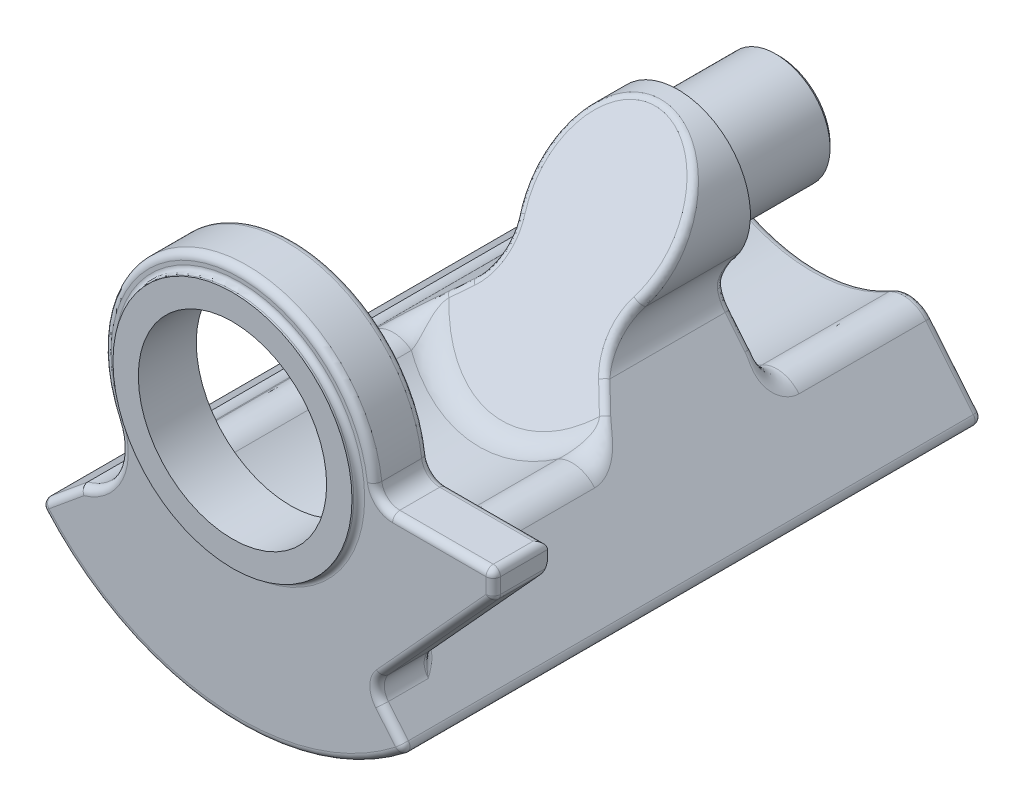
SolidWorks part; units mm, degrees
ref_plane "Plan de face" through (0, 0, 0) normal (0, 0, 1) x (1, 0, 0)
ref_plane "Plan de dessus" through (0, 0, 0) normal (0, 1, 0) x (1, 0, 0)
ref_plane "Plan de droite" through (0, 0, 0) normal (1, 0, 0) x (0, 0, -1)
sketch "Esquisse1" plane through (0, 0, 0) normal (0, 0, 1) x (1, 0, 0)
  line L0 (0, 57.9021) -> (0, -96.26) construction
  line L1 (0, 0) -> (108.6423, 0) construction
  line L2 (0, 0) -> (-55.5055, -45.86) construction
  line L3 (0, 0) -> (-61.5936, 0) construction
  line L4 (42.2049, 0) -> (70, 0)
  line L5 (70, 0) -> (70, -7)
  line L6 (45.86, -55.5055) -> (39.0709, -47.2886)
  line L7 (39.2313, -40.7344) -> (70, -7)
  line L8 (-55.5055, -45.86) -> (-43.9419, -36.3058)
  line L11 (45.86, -55.5055) -> (0, 0) construction
  arc A1 (37.2396, 4.4118) -> (-34.1143, -15.5713) centre (0, 0) ccw
  arc A2 (-55.5055, -45.86) -> (45.86, -55.5055) centre (0, 0) ccw
  arc A3 (39.0709, -47.2886) -> (39.2313, -40.7344) centre (42.9255, -44.1038) cw
  arc A4 (37.2396, 4.4118) -> (42.2049, 0) centre (42.2049, 5) ccw
  arc A5 (-34.1143, -15.5713) -> (-43.9419, -36.3058) centre (-47.76, -21.7999) cw
  point P18 (36.3058, -43.9419)
  point P21 (37.5, 0)
  dimension "D2" = 37.5
  dimension "D9" = 5
  dimension "D10" = 15
  dimension "D11" = 72
  dimension "D3" = 15
  dimension "D4" = 70
  dimension "D5" = 15
  dimension "D6" = 7
  dimension "D7" = 50
  dimension "D8" = 90
extrude "Boss.-Extru.1" add sketch "Esquisse1" along normal blind 15
sketch "Esquisse3" plane through (0, 0, 15) normal (0, 0, 1) x (1, 0, 0)
  circle A0 centre (0, 0) radius 33
  dimension "D1" = 66
extrude "Boss.-Extru.2" add sketch "Esquisse3" along normal blind 2
sketch "Esquisse4" plane through (0, 0, 17) normal (0, 0, 1) x (1, 0, 0)
  circle A0 centre (0, 0) radius 26
  dimension "D1" = 52
extrude "Enlèv. mat.-Extru.1" cut sketch "Esquisse4" against normal up to next
fillet "Congé1" radius 1.5 1 edges at (-33, 0, 15)
sketch "Esquisse5" plane through (0, 0, 0) normal (0, 0, -1) x (-1, 0, 0)
  line L0 (-45.86, -55.5055) -> (-24.2039, -29.2946)
  line L1 (43.9419, -36.3058) -> (55.5055, -45.86) construction
  line L2 (55.5055, -45.86) -> (43.9419, -36.3058)
  line L4 (0, 0) -> (39.7652, -34.4917) construction
  line L5 (36.3253, -31.508) -> (28.706, -24.8991)
  arc A0 (-45.86, -55.5055) -> (55.5055, -45.86) centre (0, 0) ccw
  arc A1 (-24.2039, -29.2946) -> (28.706, -24.8991) centre (0, 0) ccw
  arc A2 (43.9419, -36.3058) -> (36.3253, -31.508) centre (47.76, -21.7999) cw
  arc A3 (34.1143, -15.5713) -> (43.9419, -36.3058) centre (47.76, -21.7999) ccw construction
  dimension "D1" = 34
extrude "Boss.-Extru.3" add sketch "Esquisse5" along normal blind 145
sketch "Esquisse6" plane through (0, 0, 0) normal (0, 0, -1) x (-1, 0, 0)
  circle A0 centre (0, 0) radius 35
  dimension "D1" = 70
extrude "Enlèv. mat.-Extru.2" cut sketch "Esquisse6" against normal blind 1
sketch "Esquisse7" plane through (0, 0, -145) normal (0, 0, -1) x (-1, 0, 0)
  line L3 (-45.86, -55.5055) -> (-26.7517, -32.3782)
  line L4 (-24.2039, -29.2946) -> (-39.0709, -47.2886) construction
  line L5 (36.3253, -31.508) -> (28.706, -24.8991) construction
  line L6 (55.5055, -45.86) -> (43.9419, -36.3058)
  line L7 (36.3253, -31.508) -> (28.706, -24.8991)
  line L8 (-24.2039, -29.2946) -> (-45.86, -55.5055)
  line L9 (55.5055, -45.86) -> (43.9419, -36.3058)
  line L10 (31.7277, -27.5201) -> (36.3253, -31.508)
  arc A3 (-26.7517, -32.3782) -> (31.7277, -27.5201) centre (0, 0) ccw
  arc A6 (-45.86, -55.5055) -> (55.5055, -45.86) centre (0, 0) ccw
  arc A7 (36.3253, -31.508) -> (43.9419, -36.3058) centre (47.76, -21.7999) ccw
  arc A8 (-24.2039, -29.2946) -> (28.706, -24.8991) centre (0, 0) ccw
  arc A9 (-45.86, -55.5055) -> (55.5055, -45.86) centre (0, 0) ccw
  arc A10 (36.3253, -31.508) -> (43.9419, -36.3058) centre (47.76, -21.7999) ccw
  dimension "D2" = 30
  dimension "D1" = 0
extrude "Enlèv. mat.-Extru.3" cut sketch "Esquisse7" against normal blind 42 flip side to cut
ref_plane "Plan1" through (0, 0, -55) normal (0, 0, 1) x (1, 0, 0)
sketch "Esquisse17" plane through (0, 0, -55) normal (0, 0, 1) x (1, 0, 0)
  line L0 (0, -38) -> (-33.3969, -38) construction
  arc A3 (-28.706, -24.8991) -> (24.2039, -29.2946) centre (0, 0) ccw construction
  arc A4 (-28.706, -24.8991) -> (24.2039, -29.2946) centre (0, 0) ccw construction
ref_plane "Plan2" through (0, -41.0866, -52.5885) normal (0, 0.6157, 0.788) x (1, 0, 0)
sketch "Esquisse9" plane through (0, 0, -103) normal (0, 0, -1) x (-1, 0, 0)
  line L0 (-26.7517, -32.3782) -> (0, 0) construction
  line L2 (0, 0) -> (30.2168, -26.2096) construction
  line L3 (31.7277, -27.5201) -> (28.706, -24.8991) construction
  line L4 (-26.7517, -32.3782) -> (-12.7389, -15.4182)
  line L5 (31.7277, -27.5201) -> (15.1084, -13.1048)
  arc A0 (-12.7389, -15.4182) -> (15.1084, -13.1048) centre (0, 0) cw
  arc A1 (-26.7517, -32.3782) -> (31.7277, -27.5201) centre (0, 0) ccw
  arc A2 (-26.7517, -32.3782) -> (31.7277, -27.5201) centre (0, 0) ccw construction
  dimension "D1" = 20
extrude "Boss.-Extru.4" add sketch "Esquisse9" against normal up to surface (37.7645 mm away) contours A0 L4 L5 M4
sketch "Esquisse10" plane through (0, 0, -103) normal (0, 0, -1) x (-1, 0, 0)
  circle A0 centre (0, 0) radius 20
  dimension "D1" = 40
extrude "Boss.-Extru.5" add sketch "Esquisse10" along normal blind 3
sketch "Esquisse11" plane through (0, 0, -106) normal (0, 0, -1) x (-1, 0, 0)
  circle A0 centre (0, 0) radius 15
  dimension "D1" = 30
extrude "Boss.-Extru.6" add sketch "Esquisse11" along normal blind 28
chamfer "Chanfrein1" distance 1 angle 45 1 edges at (-15, 0, -134)
fillet "Congé2" radius 5 1 edges at (-3.4771, -41.8558, -103)
fillet "Congé3" radius 2 29 edges at (-55.5055, -45.86, -65) (45.86, -55.5055, -65) (-6.8204, -71.6762, -145) (-6.8204, -71.6762, 15) (36.3058, -43.9419, -145) (-3.4771, -41.8558, -145) (-34.0265, -29.5141, -145) (-39.7652, -34.4917, -145) (-49.7237, -41.0829, -145) (38.8838, 1.2623, 15) (-10.113, 36.1106, 15) (-34.2054, -28.2244, 15) (-49.7237, -41.0829, 15) (42.4654, -51.397, 15) (37.927, -43.9815, 15) (54.6156, -23.8672, 15) (70, -3.5, 15) (56.1024, 0, 15) (70, -7, 7.5) (70, 0, 7.5) (54.6156, -23.8672, 0) (-10.113, 36.1106, 0) (38.8838, 1.2623, 0) (56.1024, 0, 0)
fillet "Congé4" radius 2.5 1 edges at (-1.6558, -19.9313, -103)
fillet "Congé8" radius 10 2 edges at (-15.1084, -13.1048, -89.9751) (12.7389, -15.4182, -89.0714)
fillet "Congé19" radius 8 1 edges at (-3.146, -37.8695, -55.1019)
fillet "Congé variable1" radius 8 5 edges at (26.7517, -32.3782, -125.5) (15.7688, -14.4956, -103.2457) (16.4275, -19.1182, -103) (20.7912, -25.1641, -103) (25.8189, -31.2492, -104.4645)
fillet "Congé variable7" radius 8 9 edges at (-23.146, -20.0765, -69.0033) (-28.706, -24.8991, -30.5894) (24.2039, -29.2946, -29.2338) (-27.0085, -23.4268, -65.5498) (-18.2075, -13.3637, -74.248) (1.6558, 19.9313, -100.2609) (15.7527, -16.185, -72.0438) (19.7188, -23.8661, -66.0426) (23.7943, -28.7989, -59.922)
fillet "Congé21" radius 6 6 edges at (-31.753, -27.8845, -143.9838) (-17.9446, -11.6949, -103.2457) (-19.357, -16.1454, -103) (-24.6585, -21.3884, -103) (-30.6214, -26.5605, -104.4645) (-31.7277, -27.5201, -125.5)
